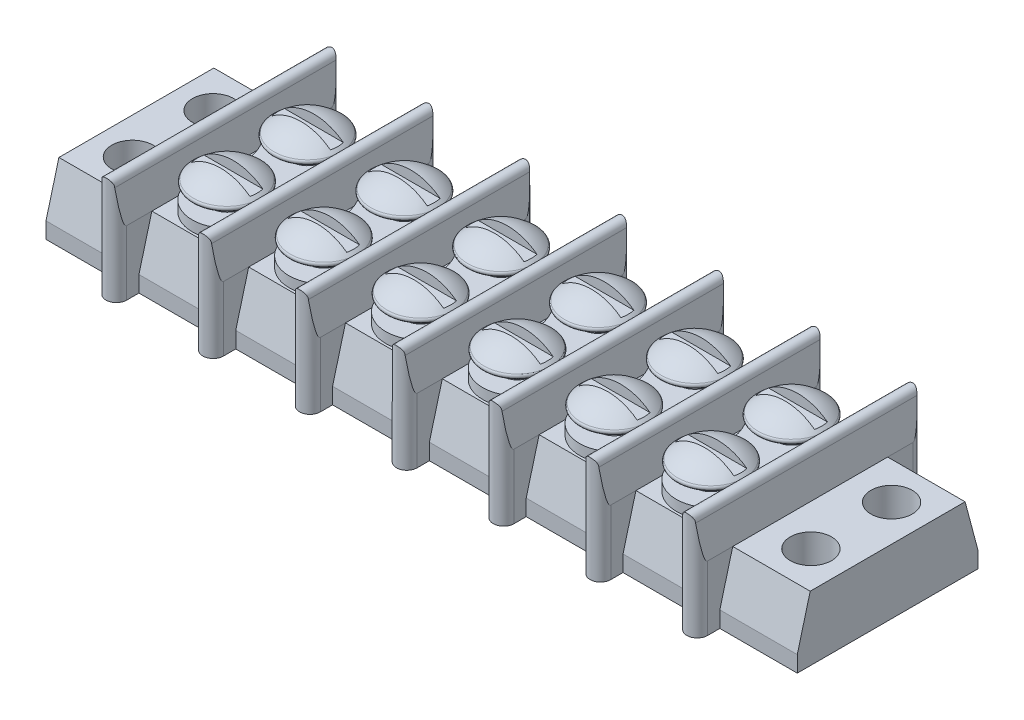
SolidWorks part; units mm, degrees
ref_plane "Front" through (0, 0, 0) normal (0, 0, 1) x (1, 0, 0)
ref_plane "Top" through (0, 0, 0) normal (0, 1, 0) x (1, 0, 0)
ref_plane "Right" through (0, 0, 0) normal (1, 0, 0) x (0, 0, -1)
sketch "Sketch1" plane through (0, 0, 0) normal (1, 0, 0) x (0, 0, -1)
  line L0 (0, -3.175) -> (0, 3.175) construction
  line L1 (-8.89, -3.175) -> (8.89, -3.175)
  line L2 (-8.89, -3.175) -> (-8.89, -1.5875)
  line L3 (-7.62, 3.175) -> (7.62, 3.175)
  line L4 (8.89, -3.175) -> (8.89, -1.5875)
  line L5 (-8.89, -1.5875) -> (-7.62, 3.175)
  line L6 (8.89, -1.5875) -> (7.62, 3.175)
  point P4 (0, -3.175)
  dimension "D1" = 6.35
  dimension "D2" = 17.78
  dimension "D3" = 1.5875
  dimension "D4" = 7.62
extrude "Extrude1" add sketch "Sketch1" along normal mid plane 73.914
other "Hole1"
sketch "Sketch2" plane through (0, 3.175, 0) normal (0, 1, 0) x (-1, 0, 0)
  line L0 (36.957, -7.62) -> (36.957, 7.62) construction
  line L1 (36.957, 0) -> (-36.957, 0) construction
  line L2 (-36.957, -7.62) -> (-36.957, 7.62) construction
  line L3 (0, -7.62) -> (0, 7.62) construction
  line L4 (-36.957, -7.62) -> (36.957, -7.62) construction
  line L5 (-36.957, 7.62) -> (36.957, 7.62) construction
  circle A0 centre (33.3756, -3.9688) radius 2.032
  circle A1 centre (33.3756, 3.9687) radius 2.032
  circle A2 centre (-33.3756, 3.9687) radius 2.032
  circle A3 centre (-33.3756, -3.9688) radius 2.032
  point P4 (36.957, 0)
  dimension "D1" = 4.064
  dimension "D3" = 3.9688
  dimension "D2" = 3.5814
sketch "Sketch3" plane through (0, -3.175, 0) normal (0, -1, 0) x (1, 0, 0)
  line L0 (-29.845, 10.0965) -> (-29.845, -10.0965)
  line L1 (-27.813, -10.0965) -> (-27.813, 10.0965)
  line L2 (-36.957, 8.89) -> (-36.957, -8.89) construction
  arc A0 (-27.813, 10.0965) -> (-29.845, 10.0965) centre (-28.829, 10.0965) ccw
  arc A1 (-29.845, -10.0965) -> (-27.813, -10.0965) centre (-28.829, -10.0965) ccw
  point P1 (-29.845, 0)
  dimension "D1" = 2.032
  dimension "D2" = 20.193
  dimension "D3" = 7.112
extrude "Extrude2" add sketch "Sketch3" against normal blind 10.414
sketch "Sketch4" plane through (0, 0, 0) normal (0, 0, 1) x (1, 0, 0)
  line L0 (-28.829, -3.175) -> (-28.829, 10.8717) construction
  line L1 (-29.845, -3.175) -> (-27.813, -3.175) construction
  line L2 (-29.464, 6.604) -> (-29.845, 3.175)
  line L3 (-27.813, 7.239) -> (-29.845, 7.239) construction
  line L4 (-28.194, 6.604) -> (-27.813, 3.175)
  arc A0 (-28.194, 6.604) -> (-29.464, 6.604) centre (-28.829, 6.604) ccw
  dimension "D2" = 1.27
  dimension "D1" = 6.34
extrude "Cut-Extrude1" cut sketch "Sketch4" against normal through all and the other way through all
pattern_linear "LPattern1" count 7 spacing 9.525 along (1, 0, 0) of "Cut-Extrude1", "Extrude2"
sketch "Sketch5" plane through (0, 3.175, 0) normal (0, 1, 0) x (1, 0, 0)
  line L0 (-24.0665, -7.62) -> (-24.0665, 7.62) construction
  line L1 (-20.32, -7.62) -> (-27.813, -7.62) construction
  line L2 (-20.32, 7.62) -> (-27.813, 7.62) construction
  line L3 (-24.0665, 0) -> (0.381, 0) construction
  line L4 (0.381, -10.8896) -> (0.381, 10.8896) construction
  arc A0 (-21.0668, 2.3074) -> (-27.0662, 2.3074) centre (-24.0665, 3.9687) ccw
  arc A1 (-21.0668, -2.3074) -> (-27.0662, -2.3074) centre (-24.0665, -3.9687) cw
  arc A2 (-27.0662, -2.3074) -> (-27.0662, 2.3074) centre (-31.2324, 0) ccw
  arc A3 (-21.0668, -2.3074) -> (-21.0668, 2.3074) centre (-16.9006, 0) cw
  circle A4 centre (-24.0665, 3.9687) radius 1.3335
  circle A5 centre (-24.0665, -3.9687) radius 1.3335
  point P8 (-24.0665, 0)
  dimension "D1" = 6.858
  dimension "D3" = 9.525
  dimension "D6" = 2.667
  dimension "D2" = 3.9688
  dimension "D4" = 7.1659
  dimension "D5" = 24.4475
extrude "Extrude3" add sketch "Sketch5" along normal blind 1.016
ref_plane "Plane1" through (-24.0792, 0, 0) normal (1, 0, 0) x (0, 0, -1)
sketch "Sketch6" plane through (-24.0792, 0, 0) normal (1, 0, 0) x (0, 0, -1)
  line L0 (-5.4864, 4.191) -> (-5.4864, 5.461)
  line L1 (-2.3074, 4.191) -> (-7.3977, 4.191) construction
  line L2 (-5.4864, 5.461) -> (-7.0608, 5.461)
  line L3 (-3.9624, 0) -> (-3.9624, 15.8994) construction
  line L4 (-3.9624, 7.239) -> (-3.9624, 4.191)
  line L5 (-3.9624, 4.191) -> (-5.4864, 4.191)
  arc A0 (-3.9624, 7.239) -> (-7.2512, 5.9449) centre (-3.9624, 2.413) ccw
  arc A1 (-7.0608, 5.461) -> (-7.2512, 5.9449) centre (-7.0608, 5.7404) cw
  dimension "D4" = 4.826
  dimension "D7" = 0.2794
  dimension "D1" = 1.27
  dimension "D2" = 3.9624
  dimension "D3" = 1.524
  dimension "D5" = 3.048
revolve "Revolve1" add sketch "Sketch6" angle 360 about L3
sketch "Sketch7" plane through (-24.0792, 0, 0) normal (1, 0, 0) x (0, 0, -1)
  line L0 (-3.9624, 5.461) -> (-3.9624, 14.8529) construction
  line L1 (-3.3274, 8.8623) -> (-4.5974, 8.8623)
  line L2 (-3.3274, 8.8623) -> (-3.3274, 6.223)
  line L3 (-3.3274, 6.223) -> (-4.5974, 6.223)
  line L4 (-4.5974, 8.8623) -> (-4.5974, 6.223)
  line L5 (-7.0608, 5.461) -> (-0.864, 5.461) construction
  point P8 (-3.9624, 6.223)
  dimension "D1" = 0.762
  dimension "D2" = 0.635
extrude "Cut-Extrude2" cut sketch "Sketch7" against normal mid plane 7.112
mirror "Mirror1" about plane through (0, 0, 0) normal (0, 0, 1) of "Cut-Extrude2", "Revolve1"
pattern_linear "LPattern2" count 6 spacing 9.525 along (1, 0, 0) of "Extrude3", "Revolve1", "Cut-Extrude2", "Mirror1"
